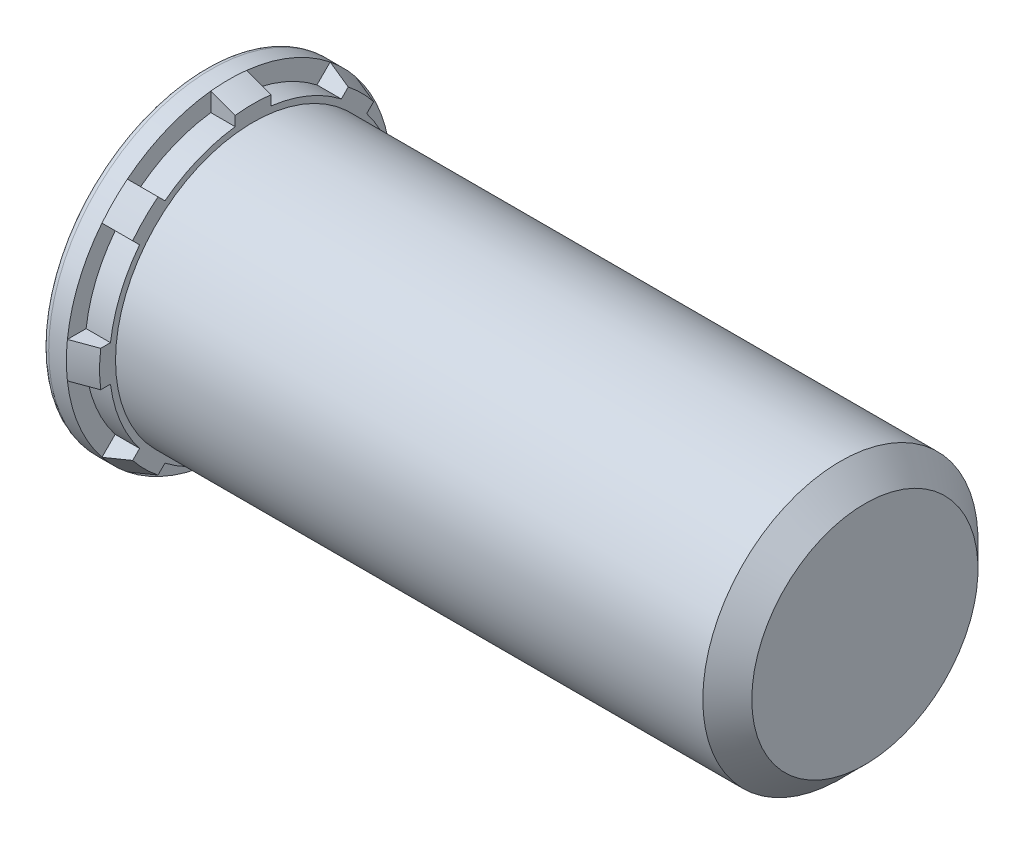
SolidWorks part; units mm, degrees
revolve "BaseBody" add sketch "BodySke" angle 360 about L6
sketch "BodySke" plane through (0, 0, 0) normal (0, 0, 1) x (1, 0, 0)
  line L0 (-0.4425, 2.8295) -> (-0.4425, 0)
  line L1 (0.4425, 2.7889) -> (0.4425, 2.5)
  line L2 (0, 2.95) -> (0.4425, 2.7889)
  line L3 (0.4425, 2.5) -> (11.1125, 2.5)
  line L4 (11.5575, 2.055) -> (11.5575, 0)
  line L5 (11.5575, 0) -> (-0.4425, 0)
  line L6 (0, 0) -> (50.554, 0) construction
  line L7 (-0.4425, 2.8295) -> (-0.44, 2.8295)
  line L8 (11.5575, 2.055) -> (11.1125, 2.5)
  line L9 (-0.322, 2.95) -> (0, 2.95)
  line L11 (0.8, 19.05) -> (0.8, -3.175) construction
  line L13 (-0.44, 2.8295) -> (-0.44, 2.832)
  arc A0 (-0.44, 2.832) -> (-0.322, 2.95) centre (-0.322, 2.832) cw
ref_plane "Plane1" through (0, 0, 0) normal (0, 0, 1) x (1, 0, 0)
ref_plane "Plane2" through (0, 0, 0) normal (0, 1, 0) x (1, 0, 0)
ref_plane "Plane3" through (0, 0, 0) normal (1, 0, 0) x (0, 0, -1)
other "Configuration Table"
sketch "ThdSchSke" plane through (0, 0, 0) normal (0, 0, 1) x (1, 0, 0)
  line L0 (2.2575, -2.055) -> (1.9459, -2.5)
  line L1 (2.2575, -2.055) -> (2.5691, -2.5)
  line L2 (2.5691, -2.5) -> (2.5691, -3.125)
  line L3 (-3.175, 0) -> (5.1513, 0) construction
  line L5 (2.5691, -3.125) -> (1.9459, -3.125)
  line L6 (1.9459, -3.125) -> (1.9459, -2.5)
  line L7 (-0.4425, 2.8295) -> (-0.4425, -2.8295) construction
revolve "ThreadSchematic" [suppressed] cut sketch "ThdSchSke" angle 360 about L3
pattern_linear "ThdSchPat" [suppressed]
sketch "RibCutSke" plane through (0.4425, 1.7944, -0.091) normal (1, 0, 0) x (0, 0, -1)
  line L0 (0.2354, 0.7976) -> (0.2354, 1.1375)
  line L1 (1.5112, 0.2692) -> (1.7515, 0.5095)
  line L2 (0.2354, 0.6842) -> (0.2354, 0.0891) construction
  line L3 (-0.091, -1.7944) -> (-0.091, 5.0239) construction
  line L4 (-0.091, -1.7944) -> (0.2354, 0.6842) construction
  line L5 (-0.091, -1.7944) -> (1.431, 0.189) construction
  line L6 (1.431, 0.189) -> (1.0152, -0.2268) construction
  arc A1 (1.5112, 0.2692) -> (0.2354, 0.7976) centre (-0.091, -1.7944) ccw
  arc A2 (1.7515, 0.5095) -> (0.2354, 1.1375) centre (-0.091, -1.7944) ccw
  circle A3 centre (-0.091, -1.7944) radius 2.7889 construction
  circle A4 centre (-0.091, -1.7944) radius 2.5 construction
extrude "RibCut" cut sketch "RibCutSke" against normal blind 0.4425
pattern_circular "RibCutsPat" count 8 every 45 about axis through (0, 0, 0) along (1, 0, 0) of "RibCut"
equation "' \"Length@BodySke\" = 12"
equation "' \"H_dia@BodySke\" = 5.9"
equation "' \"Start@ThdSchSke\" = 2.7"
equation "' \"Diameter@BodySke\" = 5"
equation "' \"Minor_dia@BodySke\" = 4.11"
equation "' \"Advance@BodySke\" = 0.8"
equation "\"Fillet_rad@BodySke\" =   \"H_dia@BodySke\" *0.02"
equation "\"Clinch_ht@BodySke\" = \"H_dia@BodySke\" * 0.075"
equation "\"Head_ht@BodySke\" =  \"H_dia@BodySke\" * 0.15"
equation "\"Num_ribs@RibCutsPat\" = 8"
equation "\"Angle@RibCutSke\" =\"Angle@RibCutsPat\""
equation "\"Rib_root_half_angle@RibCutSke\" = \"Angle@RibCutSke\" / 6"
equation "\"Rib_root_gap_angle@RibCutSke\" = \"Angle@RibCutSke\" - (2 * \"Rib_root_half_angle@RibCutSke\" )"
equation "\"Rib_root_dia@RibCutSke\" = \"Diameter@BodySke\""
equation "\"Inner_dia@RibCutSke\" = \"Diameter@BodySke\" + ( \"H_dia@BodySke\" - \"Diameter@BodySke\" ) / 4"
equation "\"Outer_dia@RibCutSke\" = \"H_dia@BodySke\""
equation "\"Depth@RibCut\" = \"Clinch_ht@BodySke\""
equation "\"Thread_length@ThreadCosmetic\" = \"Length@BodySke\" - \"Start@ThdSchSke\""
equation "\"Thread_minor@ThreadCosmetic\" = \"Minor_dia@BodySke\""
equation "\"Thread_minor@ThdSchSke\" = \"Minor_dia@BodySke\""
equation "\"Diameter@ThdSchSke\" = \"Diameter@BodySke\""
equation "\"Overcut@ThdSchSke\" = \"Diameter@BodySke\" * 1.25"
equation "\"Num_threads@ThdSchPat\" = int( \"Thread_length@ThreadCosmetic\" / \"Advance@BodySke\" + 0.999 )  + 1"
equation "\"Advance@ThdSchPat\" = \"Thread_length@ThreadCosmetic\" /  (\"Num_threads@ThdSchPat\" - 1) 'relax it"
equation "\"Num_threads@ThdSchPat\" = \"Num_threads@ThdSchPat\" - sgn( \"Num_threads@ThdSchPat\" - 1) '---chamfered tips only---"
